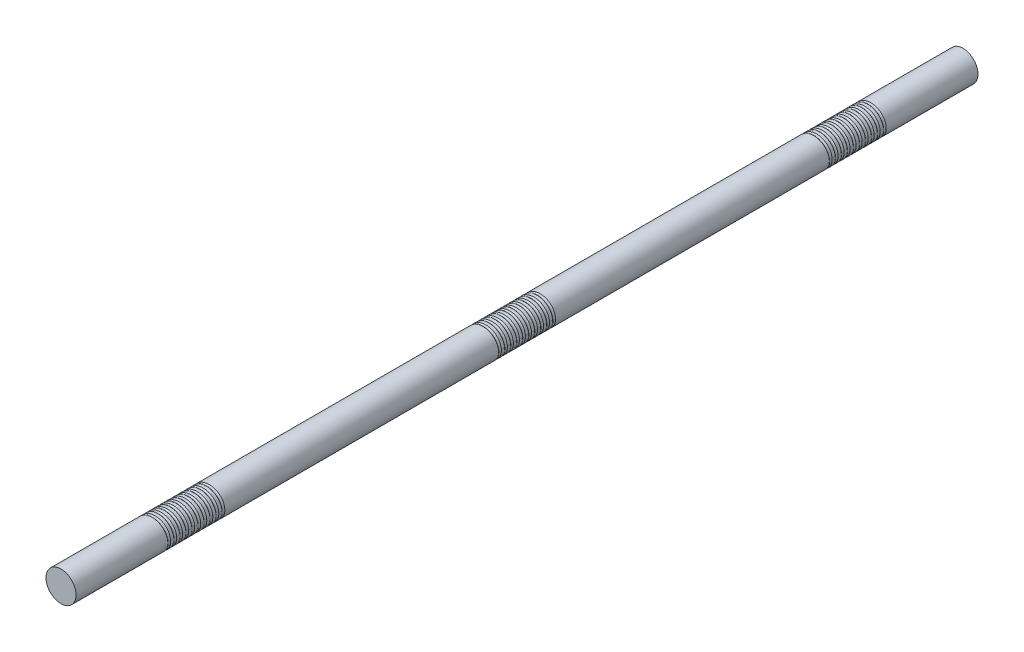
SolidWorks part; units mm, degrees
ref_plane "Front Plane" through (0, 0, 0) normal (0, 0, 1) x (1, 0, 0)
ref_plane "Top Plane" through (0, 0, 0) normal (0, 1, 0) x (1, 0, 0)
ref_plane "Right Plane" through (0, 0, 0) normal (1, 0, 0) x (0, 0, -1)
sketch "Sketch1" plane through (0, 0, 0) normal (0, 0, 1) x (1, 0, 0)
  circle A0 centre (0, 0) radius 25
  dimension "D1" = 50
extrude "Boss-Extrude1" add sketch "Sketch1" along normal blind 1500
ref_plane "Plane1" through (0, 0, 150) normal (0, 0, 1) x (1, 0, 0)
sketch "Sketch2" plane through (0, 0, 150) normal (0, 0, 1) x (1, 0, 0)
  circle A0 centre (0, 0) radius 27.1167
  dimension "D1" = 54.2333
curve "Helix/Spiral1"
sketch "Sketch3" plane through (0, 0, 0) normal (0, 1, 0) x (1, 0, 0)
  circle A0 centre (-27.1167, -150) radius 3.175
  spline S0 degree 3 number of poles 233 (-27.1167, -150) -> (-27.1167, -250) construction
  dimension "D1" = 6.35
sweep "Cut-Sweep1" cut profiles "Sketch3" path "Helix/Spiral1"
pattern_linear "LPattern1" count 3 spacing 550 along (0, 0, -1) of "Cut-Sweep1"
